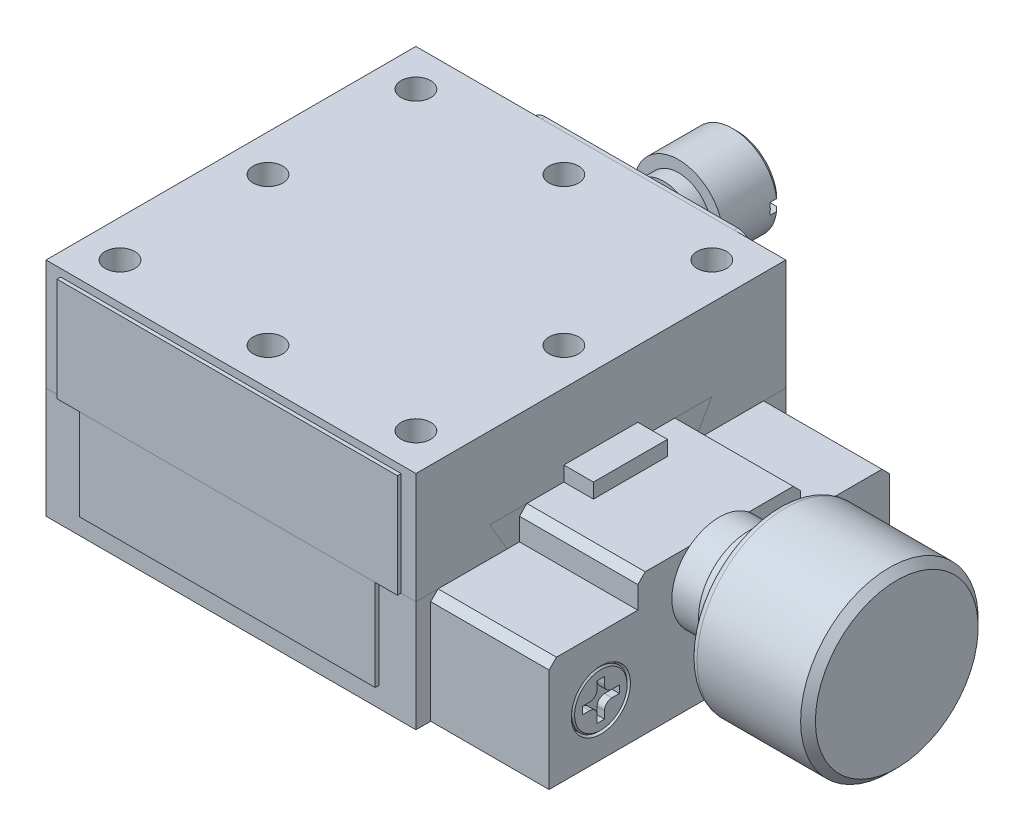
SolidWorks part; units mm, degrees
ref_plane "Front Plane" through (0, 0, 0) normal (0, 0, 1) x (1, 0, 0)
ref_plane "Top Plane" through (0, 0, 0) normal (0, 1, 0) x (1, 0, 0)
ref_plane "Right Plane" through (0, 0, 0) normal (1, 0, 0) x (0, 0, -1)
sketch "Sketch1" plane through (0, 0, 0) normal (0, 0, 1) x (1, 0, 0)
  line L0 (-17.5553, 0) -> (22.6305, 0) construction
  line L1 (-12.5, 7.5) -> (12.5, 7.5)
  line L2 (-12.5, 7.5) -> (-12.5, -7.5)
  line L3 (-12.5, -7.5) -> (12.5, -7.5)
  line L4 (12.5, 7.5) -> (12.5, -7.5)
  line L5 (0, 11.3249) -> (0, -12.2184) construction
  dimension "D1" = 25
  dimension "D2" = 15
extrude "Extrude1" add sketch "Sketch1" against normal mid plane 25
sketch "Sketch3" plane through (-12.5, 0, 0) normal (-1, 0, 0) x (0, 0, 1)
  line L0 (-12.5, 0) -> (-6.3453, 0)
  line L2 (-6.3453, 0) -> (-7.5, 2)
  line L3 (-7.5, 2) -> (7.5, 2)
  line L4 (7.5, 2) -> (6.3453, 0)
  line L5 (6.3453, 0) -> (12.5, 0)
  line L7 (0, 9.2862) -> (0, -8.8555) construction
  line L9 (-12.5, -7.5) -> (12.5, -7.5) construction
  line L10 (-12.5, 7.5) -> (-12.5, -7.5) construction
  line L11 (12.5, 7.5) -> (12.5, -7.5) construction
  dimension "D1" = 15
  dimension "D2" = 2
  dimension "D3" = 60
  dimension "D4" = 7.5
split "Split1" trim tools "Sketch3" resulting bodies 102 103
sketch "Sketch4" plane through (12.5, 0, 0) normal (1, 0, 0) x (0, 0, -1)
  line L0 (-11.5, -7.5) -> (-11.5, 0)
  line L1 (-12.5, 0) -> (-6.3453, 0) construction
  line L2 (-11.5, 0) -> (-5.5, 0)
  line L3 (-5.5, 0) -> (-5.5, 2)
  line L4 (-5.5, 2) -> (5.5, 2)
  line L5 (5.5, 2) -> (5.5, 0)
  line L6 (5.5, 0) -> (11.5, 0)
  line L7 (6.3453, 0) -> (12.5, 0) construction
  line L8 (11.5, 0) -> (11.5, -7.5)
  line L9 (11.5, -7.5) -> (-11.5, -7.5)
  line L10 (0, 10.5069) -> (0, -9.7219) construction
  line L12 (-7.5, 2) -> (7.5, 2) construction
  line L13 (12.5, -7.5) -> (-12.5, -7.5) construction
  dimension "D1" = 11
  dimension "D2" = 23
extrude "Extrude2" add sketch "Sketch4" along normal blind 8 separate body
sketch "Sketch5" plane through (0, 0, 0) normal (0, 0, 1) x (1, 0, 0)
  line L0 (-16.9557, -0.5) -> (34.9975, -0.5) construction
  line L1 (20.5, -0.5) -> (20.5, 2.7)
  line L2 (20.5, 2.7) -> (22.5, 2.7)
  line L3 (22.5, 2.7) -> (22.5, 2.9)
  line L4 (24.5, 2.9) -> (24.5, 5)
  line L5 (25, 5.5) -> (32, 5.5)
  line L6 (32.5, 5) -> (32.5, -0.5)
  line L7 (20.5, 0) -> (20.5, -7.5) construction
  line L8 (12.5, -7.5) -> (12.5, 0) construction
  line L10 (-12.5, -7.5) -> (12.5, -7.5) construction
  line L11 (32, 5.5) -> (32.5, 5)
  line L12 (20.5, 2) -> (12.5, 2) construction
  line L13 (22.5, 2.9) -> (24.5, 2.9)
  line L14 (20.5, -0.5) -> (32.5, -0.5)
  arc A0 (24.5, 5) -> (25, 5.5) centre (25, 5) cw
  point P17 (32.5, 5.5)
  dimension "D4" = 0.5
  dimension "D1" = 20
  dimension "D2" = 12
  dimension "D3" = 7
  dimension "D6" = 0.5
  dimension "D5" = 2
  dimension "D7" = 0.7
  dimension "D8" = 0.2
revolve "Revolve1" add sketch "Sketch5" angle 360 about L0
ref_plane "Plane1" through (0, 0, 10) normal (0, 0, 1) x (1, 0, 0)
sketch "Sketch7" plane through (0, 0, 10) normal (0, 0, 1) x (1, 0, 0)
  line L0 (0, 10.5598) -> (0, -0.7863) construction
  line L1 (12.5, 7.5) -> (-12.5, 7.5) construction
  line L2 (0, 7.5) -> (1, 7.5)
  line L3 (0, 7.5) -> (0, 0.8991)
  line L4 (-0.3822, 1.5) -> (1.4322, 1.5) construction
  line L5 (1, 7.5) -> (1, 1.5)
  line L6 (1, 1.5) -> (0, 0.8991)
  dimension "D1" = 59
  dimension "D2" = 6
  dimension "D3" = 2
revolve "Cut-Revolve1" cut sketch "Sketch7" angle 360 about L0
pattern_linear "LPattern1" count 2 spacing 10 along (1, 0, 0) count 2 spacing 10 along (-1, 0, 0) of "Cut-Revolve1"
pattern_linear "LPattern2" count 2 spacing 20 along (0, 0, -1) of "LPattern1", "Cut-Revolve1"
sketch "Sketch8" plane through (0, 0, 0) normal (0, 0, 1) x (1, 0, 0)
  line L0 (-10, 8.7759) -> (-10, -1.8346) construction
  line L1 (12.5, 7.5) -> (-12.5, 7.5) construction
  line L2 (-10, 7.5) -> (-9, 7.5)
  line L3 (-10, 7.5) -> (-10, 1.3991)
  line L4 (-10, 1.3991) -> (-9, 2)
  line L5 (-9, 7.5) -> (-9, 2)
  line L6 (12.5, 2) -> (-12.5, 2) construction
  dimension "D2" = 2
  dimension "D3" = 10
  dimension "D4" = 59
revolve "Cut-Revolve2" cut sketch "Sketch8" angle 360 about L0
pattern_linear "LPattern3" count 2 spacing 20 along (1, 0, 0) of "Cut-Revolve2"
sketch "Sketch9" plane through (0, 2, 0) normal (0, 1, 0) x (-1, 0, 0)
  line L0 (-12.5, -12.5) -> (-12.5, 12.5) construction
  line L1 (-14.5, -2.5) -> (-12.5, -2.5)
  line L2 (-14.5, -2.5) -> (-14.5, 2.5)
  line L3 (-14.5, 2.5) -> (-12.5, 2.5)
  line L4 (-12.5, -2.5) -> (-12.5, 2.5)
  line L5 (-17.8737, 0) -> (-1.2554, 0) construction
  dimension "D1" = 5
  dimension "D2" = 2
extrude "Extrude3" add sketch "Sketch9" along normal blind 1 separate body
ref_plane "Plane2" through (2.5, 0, 0) normal (1, 0, 0) x (0, 0, -1)
sketch "Sketch10" plane through (2.5, 0, 0) normal (1, 0, 0) x (0, 0, -1)
  line L0 (-16.0871, 4) -> (16.1877, 4) construction
  line L1 (12.5, -7.5) -> (-12.5, -7.5) construction
  line L2 (12.75, 5.98) -> (14.25, 5.98)
  line L3 (12.5, -7.5) -> (12.5, 0) construction
  line L4 (14.25, 5.98) -> (14.25, 6.23)
  line L5 (14.25, 6.23) -> (15.25, 6.23)
  line L6 (15.25, 6.23) -> (15.25, 7)
  line L7 (15.25, 7) -> (18.9, 7)
  line L8 (19.2, 6.7) -> (19.2, 4)
  line L9 (19.2, 4) -> (12.5, 4)
  line L10 (12.75, 4.98) -> (12.75, 5.98)
  line L11 (18.9, 7) -> (19.2, 6.7)
  line L12 (12.5, 0) -> (12.5, 7.5) construction
  line L13 (12.75, 4.98) -> (12.5, 4.98)
  line L14 (12.5, 4.98) -> (12.5, 4)
  point P16 (19.2, 7)
  dimension "D1" = 11.5
  dimension "D2" = 6
  dimension "D3" = 6.7
  dimension "D4" = 0.25
  dimension "D5" = 1
  dimension "D6" = 0.98
  dimension "D7" = 0.25
  dimension "D8" = 1
  dimension "D10" = 0.3
  dimension "D9" = 1.5
revolve "Revolve2" add sketch "Sketch10" angle 360 about L0
sketch "Sketch11" plane through (2.5, 0, 0) normal (1, 0, 0) x (0, 0, -1)
  line L0 (19.2, 1.3) -> (19.2, 6.7) construction
  line L1 (18.45, 4.375) -> (19.2, 4.375)
  line L2 (18.45, 4.375) -> (18.45, 3.625)
  line L3 (18.45, 3.625) -> (19.2, 3.625)
  line L4 (19.2, 4.375) -> (19.2, 3.625)
  line L5 (10.1527, 4) -> (21.4889, 4) construction
  line L6 (-16.0871, 4) -> (16.1877, 4) construction
  dimension "D1" = 0.75
  dimension "D2" = 0.75
extrude "Cut-Extrude2" cut sketch "Sketch11" against normal mid plane 11.5
sketch "Sketch12" plane through (0, 0, 10) normal (0, 0, 1) x (1, 0, 0)
  line L0 (-10, 0.5868) -> (-10, -12.2814) construction
  line L1 (-10, 0) -> (-7.9, 0)
  line L2 (-12.5, 0) -> (12.5, 0) construction
  line L3 (-7.9, 0) -> (-7.9, -3)
  line L4 (-7.9, -3) -> (-8.75, -3)
  line L5 (-8.75, -3) -> (-8.75, -7.5)
  line L6 (-12.5, -7.5) -> (12.5, -7.5) construction
  line L7 (-8.75, -7.5) -> (-10, -7.5)
  line L8 (-10, -7.5) -> (-10, 0)
  dimension "D1" = 10
  dimension "D2" = 2.5
  dimension "D3" = 4.2
  dimension "D4" = 4.5
revolve "Cut-Revolve3" cut sketch "Sketch12" angle 360 about L0
pattern_linear "LPattern4" count 2 spacing 20 along (0, 0, -1) count 2 spacing 20 along (1, 0, 0) of "Cut-Revolve3"
sketch "Sketch13" plane through (0, 0, 12.5) normal (0, 0, 1) x (1, 0, 0)
  line L0 (-11.5, -5.15) -> (-11.5, 0)
  line L2 (11.5, 0) -> (11.5, -5.15)
  line L4 (-11.5, 0) -> (11.5, 0)
  line L6 (-12.5, 0) -> (12.5, 0) construction
  line L8 (10.5, -6.15) -> (-10.5, -6.15)
  line L11 (0, 14.0975) -> (0, -10.6657) construction
  arc A0 (-11.5, -5.15) -> (-10.5, -6.15) centre (-10.5, -5.15) ccw
  arc A1 (10.5, -6.15) -> (11.5, -5.15) centre (10.5, -5.15) ccw
  point P24 (-11.5, -6.15)
  dimension "D3" = 1
  dimension "D1" = 6.15
  dimension "D2" = 23
extrude "Extrude4" add sketch "Sketch13" along normal blind 0.25 separate body
sketch "Sketch14" plane through (0, 0, -12.5) normal (0, 0, -1) x (-1, 0, 0)
  line L0 (12.5, -7.5) -> (-12.5, -7.5) construction
  line L2 (5, -6.5) -> (5, 6.5)
  line L3 (-12.5, 7.5) -> (12.5, 7.5) construction
  line L4 (4, 7.5) -> (-9, 7.5)
  line L5 (-10, 6.5) -> (-10, -6.5)
  line L6 (-12.5, 0) -> (-12.5, 7.5) construction
  line L7 (-8, 5) -> (3, 5)
  line L8 (-8.5, 4.5) -> (-8.5, 3.5)
  line L9 (-8, 3) -> (3, 3)
  line L10 (3.5, 4.5) -> (3.5, 3.5)
  line L11 (-2.5, 14.1335) -> (-2.5, -6.1072) construction
  line L12 (-14.0826, 4) -> (7.454, 4) construction
  line L13 (-9, -7.5) -> (4, -7.5)
  arc A0 (-10, -6.5) -> (-9, -7.5) centre (-9, -6.5) ccw
  arc A1 (-9, 7.5) -> (-10, 6.5) centre (-9, 6.5) ccw
  arc A2 (5, 6.5) -> (4, 7.5) centre (4, 6.5) ccw
  arc A3 (5, -6.5) -> (4, -7.5) centre (4, -6.5) cw
  arc A5 (-8, 5) -> (-8.5, 4.5) centre (-8, 4.5) ccw
  arc A6 (-8.5, 3.5) -> (-8, 3) centre (-8, 3.5) ccw
  arc A7 (3, 3) -> (3.5, 3.5) centre (3, 3.5) ccw
  arc A8 (3, 5) -> (3.5, 4.5) centre (3, 4.5) cw
  point P20 (-10, 7.5)
  point P23 (5, 7.5)
  point P32 (-8.5, 5)
  point P39 (3.5, 5)
  point P40 (-10, -7.5)
  point P43 (5, -7.5)
  dimension "D5" = 1
  dimension "D6" = 0.5
  dimension "D9" = 1
  dimension "D1" = 2.5
  dimension "D2" = 15
  dimension "D4" = 12
  dimension "D7" = 2
  dimension "D8" = 11.5
extrude "Extrude6" add sketch "Sketch14" along normal blind 0.25 separate body
sketch "Sketch26" plane through (0, 0, 12.5) normal (0, 0, 1) x (1, 0, 0)
  line L0 (11.5, -5.15) -> (11.5, 0) construction
  line L1 (-11.5, 0) -> (11.5, 0)
  line L2 (-11.5, 0) -> (-11.5, 7)
  line L3 (-11.5, 7) -> (11.5, 7)
  line L4 (11.5, 0) -> (11.5, 7)
  dimension "D1" = 7
extrude "Extrude9" add sketch "Sketch26" along normal blind 0.25 separate body
sketch "Sketch15" plane through (20.5, 0, 0) normal (1, 0, 0) x (0, 0, -1)
  line L0 (0, 12.9894) -> (0, -12.6202) construction
  circle A0 centre (-8, -4) radius 2
  circle A1 centre (8, -4) radius 2
  dimension "D1" = 4
  dimension "D2" = 16
  dimension "D3" = 4
extrude "Cut-Extrude3" cut sketch "Sketch15" against normal blind 2
sketch "Sketch16" plane through (18.5, 0, 0) normal (1, 0, 0) x (0, 0, -1)
  circle A0 centre (-8, -4) radius 1.875
  circle A1 centre (-8, -4) radius 2 construction
  dimension "D1" = 3.75
extrude "Extrude7" add sketch "Sketch16" along normal blind 2 separate body
chamfer "Chamfer1" distance 0.1 angle 45 1 edges at (20.5, -2.125, 8)
sketch "Sketch17" plane through (20.5, 0, 0) normal (1, 0, 0) x (0, 0, -1)
  line L0 (-8, -2.6113) -> (-8, -5.3425) construction
  line L1 (-9.4433, -4) -> (-6.9033, -4) construction
  line L2 (-9.25, -4.25) -> (-9.25, -3.75)
  line L3 (-9.25, -3.75) -> (-8.25, -3.75)
  line L4 (-8.25, -3.75) -> (-8.25, -2.75)
  line L5 (-8.25, -2.75) -> (-7.75, -2.75)
  line L6 (-7.75, -2.75) -> (-7.75, -3.75)
  line L7 (-7.75, -3.75) -> (-6.75, -3.75)
  line L8 (-6.75, -3.75) -> (-6.75, -4.25)
  line L9 (-6.75, -4.25) -> (-7.75, -4.25)
  line L10 (-7.75, -4.25) -> (-7.75, -5.25)
  line L11 (-7.75, -5.25) -> (-8.25, -5.25)
  line L12 (-8.25, -5.25) -> (-8.25, -4.25)
  line L13 (-8.25, -4.25) -> (-9.25, -4.25)
  dimension "D1" = 0.5
  dimension "D2" = 8
  dimension "D3" = 2.5
  dimension "D4" = 2.5
  dimension "D5" = 0.5
  dimension "D6" = 4
extrude "Cut-Extrude4" cut sketch "Sketch17" against normal blind 0.5
fillet "Fillet2" radius 0.5 4 edges at (20.25, -4.25, 7.75) (20.25, -4.25, 8.25) (20.25, -3.75, 8.25) (20.25, -3.75, 7.75)
pattern_linear "LPattern5" count 2 spacing 16 along (0, 0, -1)
sketch "Sketch18" plane through (0, 0, -12.75) normal (0, 0, -1) x (-1, 0, 0)
  line L0 (-2.5, 10.7386) -> (-2.5, -9.8413) construction
  line L1 (-9, -7.5) -> (4, -7.5) construction
  circle A0 centre (-4.5, -5) radius 1
  circle A1 centre (-0.5, -5) radius 1
  dimension "D2" = 2
  dimension "D1" = 2.5
  dimension "D3" = 2.5
  dimension "D4" = 4
extrude "Extrude8" add sketch "Sketch18" along normal blind 0.8 separate body
fillet "Fillet1" radius 0.25 1 edges at (3.5, -5, -13.55)
fillet "Fillet3" radius 0.25 1 edges at (-0.5, -5, -13.55)
sketch "Sketch19" plane through (0, 0, -13.55) normal (0, 0, -1) x (-1, 0, 0)
  line L0 (-8.4281, -5) -> (-5.6071, -5) construction
  line L1 (-4.6, -4.25) -> (-4.4, -4.25)
  line L2 (-4.4, -4.25) -> (-4.4, -4.9)
  line L3 (-4.4, -4.9) -> (-3.75, -4.9)
  line L4 (-3.75, -4.9) -> (-3.75, -5.1)
  line L5 (-3.75, -5.1) -> (-4.4, -5.1)
  line L6 (-4.4, -5.1) -> (-4.4, -5.75)
  line L7 (-4.4, -5.75) -> (-4.6, -5.75)
  line L8 (-4.6, -5.75) -> (-4.6, -5.1)
  line L9 (-4.6, -5.1) -> (-5.25, -5.1)
  line L10 (-5.25, -5.1) -> (-5.25, -4.9)
  line L11 (-5.25, -4.9) -> (-4.6, -4.9)
  line L12 (-4.6, -4.9) -> (-4.6, -4.25)
  line L13 (-4.5, 2.5) -> (-4.5, 0.5) construction
  line L14 (-0.6, -5.1) -> (-0.6, -5.75)
  line L15 (-9, -7.5) -> (4, -7.5) construction
  line L16 (-0.4, -5.1) -> (-0.4, -5.75)
  line L17 (-0.5, -2.5823) -> (-0.5, -6.9988) construction
  line L20 (-1.25, -4.9) -> (-0.6, -4.9)
  line L21 (-1.25, -4.9) -> (-1.25, -5.1)
  line L22 (-1.25, -5.1) -> (-0.6, -5.1)
  line L24 (0.25, -4.9) -> (-0.4, -4.9)
  line L25 (0.25, -4.9) -> (0.25, -5.1)
  line L26 (0.25, -5.1) -> (-0.4, -5.1)
  line L28 (-0.6, -4.25) -> (-0.4, -4.25)
  line L29 (-0.6, -4.25) -> (-0.6, -4.9)
  line L30 (-0.6, -5.75) -> (-0.4, -5.75)
  line L31 (-0.4, -4.25) -> (-0.4, -4.9)
  dimension "D1" = 1.5
  dimension "D2" = 0.2
  dimension "D3" = 4.5
  dimension "D4" = 2.5
  dimension "D5" = 1.5
  dimension "D6" = 4
extrude "Cut-Extrude5" cut sketch "Sketch19" against normal blind 0.25
sketch "Sketch20" plane through (0, 0, 12.75) normal (0, 0, 1) x (1, 0, 0)
  line L0 (-10.5, -6.15) -> (10.5, -6.15) construction
  line L1 (11.5, 0) -> (-11.5, 0) construction
  line L2 (-11.5, 0) -> (-11.5, -6.15)
  line L3 (-11.5, -6.15) -> (-10, -6.15)
  line L4 (-10, 0) -> (-10, -6.15)
  line L6 (0, 12.0283) -> (0, -10.5142) construction
  line L7 (10, 0) -> (10, -6.15)
  line L8 (11.5, -6.15) -> (10, -6.15)
  line L9 (11.5, 0) -> (11.5, -6.15)
  line L10 (11.5, 0) -> (10, 0)
  line L11 (-11.5, 0) -> (-11.5, -5.15) construction
  line L12 (-11.5, 0) -> (-10, 0)
  dimension "D1" = 1.5
extrude "Cut-Extrude6" cut sketch "Sketch20" against normal up to next
chamfer "Chamfer2" distance 0.5 angle 45 4 edges at (16.5, 2, 5.5) (16.5, 2, -5.5) (16.5, 0, -11.5) (16.5, 0, 11.5)
sketch "草圖1" plane through (-12.5, 0, -25) normal (1, 0, 0) x (0, 0, -1)
  line L1 (-16.1981, -4.1156) -> (-15.311, -4.1204)
  line L2 (-17.0651, -2.4109) -> (-17.0651, -2.4974)
  line L3 (-16.2352, -3.1633) -> (-15.9187, -3.5702)
  line L40 (-16.573, -3.1631) -> (-16.2352, -3.1633)
  line L41 (-16.1981, -4.1156) -> (-16.573, -3.1631)
  line L42 (-17.6614, -2.8336) -> (-18.1987, -2.8336)
  line L43 (-18.2924, -2.5911) -> (-18.2924, -2.74)
  line L44 (-18.0266, -3.531) -> (-17.6614, -3.531)
  line L45 (-18.0266, -3.3031) -> (-18.0266, -3.531)
  line L46 (-18.0266, -3.3031) -> (-17.7774, -3.3031)
  line L47 (-17.6837, -3.0489) -> (-17.6837, -3.2095)
  line L48 (-18.2858, -3.0489) -> (-18.2858, -3.7827)
  line L49 (-18.2858, -3.0489) -> (-17.6837, -3.0489)
  line L50 (-19.4085, -2.5911) -> (-19.0585, -3.4026)
  line L51 (-19.4521, -3.0898) -> (-19.1461, -3.7827)
  line L52 (-19.4521, -3.0898) -> (-19.4521, -3.6891)
  line L53 (-19.7468, -2.5911) -> (-19.7468, -3.7827)
  line L54 (-18.665, -3.0898) -> (-18.971, -3.7827)
  line L55 (-18.665, -3.0898) -> (-18.665, -3.6891)
  line L56 (-18.7085, -2.5911) -> (-19.0585, -3.4026)
  line L57 (-18.2858, -3.7827) -> (-17.6614, -3.7827)
  line L58 (-18.5713, -3.7827) -> (-18.3702, -3.7827)
  line L59 (-19.1461, -3.7827) -> (-18.971, -3.7827)
  line L60 (-19.7468, -3.7827) -> (-19.5457, -3.7827)
  line L61 (-18.3702, -2.5911) -> (-18.3702, -3.7827)
  line L62 (-18.2924, -2.5911) -> (-17.6614, -2.5911)
  line L63 (-18.7085, -2.5911) -> (-18.3702, -2.5911)
  line L64 (-19.7468, -2.5911) -> (-19.4085, -2.5911)
  line L65 (-20.3083, -3.7834) -> (-20.5174, -3.7851)
  line L66 (-20.2154, -2.8878) -> (-20.2154, -3.6898)
  line L67 (-19.8284, -2.8878) -> (-20.2154, -2.8878)
  line L68 (-19.8284, -2.5911) -> (-19.8284, -2.8878)
  line L69 (-20.9095, -2.5911) -> (-19.8284, -2.5911)
  line L70 (-20.9095, -2.7998) -> (-20.9095, -2.5911)
  line L71 (-20.5174, -2.8934) -> (-20.8159, -2.8934)
  line L72 (-20.5174, -2.8934) -> (-20.5174, -3.7851)
  arc A44 (-17.0651, -2.4109) -> (-16.9244, -2.4189) centre (-17.0496, -3.3828) cw
  arc A45 (-16.6772, -2.442) -> (-16.9244, -2.4189) centre (-15.3108, 13.5103) cw
  arc A46 (-16.7864, -2.4322) -> (-16.5941, -2.4511) centre (-17.1549, -7.1859) cw
  arc A47 (-16.5941, -2.4511) -> (-16.3851, -2.4781) centre (-16.7619, -4.5724) cw
  arc A48 (-16.3851, -2.4781) -> (-16.1496, -2.5058) centre (-16.4783, -4.2807) cw
  arc A49 (-16.1496, -2.5058) -> (-15.9475, -2.5343) centre (-16.209, -3.6581) cw
  arc A50 (-15.7222, -2.5771) -> (-15.9475, -2.5343) centre (-15.4093, -0.3111) cw
  arc A51 (-15.7222, -2.5771) -> (-15.4621, -2.6273) centre (-17.0996, -10.4031) cw
  arc A52 (-15.4621, -2.6273) -> (-15.1846, -2.6976) centre (-16.2634, -6.3745) cw
  arc A53 (-15.1846, -2.6976) -> (-14.9177, -2.7748) centre (-15.7421, -5.1236) cw
  arc A54 (-14.9177, -2.7748) -> (-14.7336, -2.84) centre (-28.3932, -41.1646) cw
  arc A55 (-14.7336, -2.84) -> (-14.4724, -2.9583) centre (-15.8525, -5.6559) cw
  arc A56 (-14.4724, -2.9583) -> (-14.1987, -3.1141) centre (-16.0097, -5.9785) cw
  arc A57 (-14.1987, -3.1141) -> (-13.9713, -3.3372) centre (-14.9246, -4.0815) cw
  arc A58 (-13.9713, -3.3372) -> (-13.8744, -3.5708) centre (-14.2826, -3.6031) cw
  arc A59 (-13.8744, -3.5708) -> (-13.9502, -3.7497) centre (-14.1121, -3.5756) cw
  arc A60 (-13.9502, -3.7497) -> (-14.245, -3.9392) centre (-14.5856, -3.0851) cw
  arc A61 (-14.245, -3.9392) -> (-14.6816, -4.0519) centre (-15.1643, -1.28) cw
  arc A62 (-14.6816, -4.0519) -> (-15.0135, -4.0942) centre (-15.4536, 0.6734) cw
  arc A63 (-15.311, -4.1204) -> (-15.0135, -4.0942) centre (-12.6714, -32.4168) cw
  arc A64 (-17.0651, -2.4974) -> (-16.9142, -2.5137) centre (-17.1052, -3.5767) cw
  arc A65 (-16.9142, -2.5137) -> (-16.729, -2.5393) centre (-18.8958, -17.5551) cw
  arc A66 (-16.5268, -2.5702) -> (-16.729, -2.5393) centre (-16.4493, -1.3852) cw
  arc A67 (-16.2993, -2.6109) -> (-16.5268, -2.5702) centre (-16.0828, -0.7447) cw
  arc A68 (-16.2993, -2.6109) -> (-16.0587, -2.6574) centre (-17.5664, -9.8163) cw
  arc A69 (-15.8705, -2.6967) -> (-16.0587, -2.6574) centre (-15.65, -1.1709) cw
  arc A70 (-15.8705, -2.6967) -> (-15.6458, -2.7556) centre (-16.0752, -3.9343) cw
  arc A71 (-15.4193, -2.8232) -> (-15.6458, -2.7556) centre (-10.0771, 15.4936) cw
  arc A72 (-15.1665, -2.9229) -> (-15.4193, -2.8232) centre (-13.2471, 2.3154) cw
  arc A73 (-15.1665, -2.9229) -> (-14.9629, -3.0338) centre (-15.8291, -4.3818) cw
  arc A74 (-14.9629, -3.0338) -> (-14.8122, -3.1675) centre (-15.3005, -3.5659) cw
  arc A75 (-14.8122, -3.1675) -> (-14.7678, -3.2687) centre (-14.96, -3.2928) cw
  arc A76 (-14.7678, -3.2687) -> (-14.8383, -3.3911) centre (-14.9084, -3.2692) cw
  arc A77 (-14.8383, -3.3911) -> (-15.1184, -3.5058) centre (-15.2533, -2.7769) cw
  arc A78 (-15.1184, -3.5058) -> (-15.4786, -3.5538) centre (-15.4959, -2.0486) cw
  arc A79 (-15.4786, -3.5538) -> (-15.9187, -3.5702) centre (-15.872, 1.0836) cw
  arc A80 (-17.6614, -2.5911) -> (-17.6614, -3.7827) centre (-17.7632, -3.1869) cw
  arc A81 (-17.6614, -2.8336) -> (-17.6614, -3.531) centre (-17.879, -3.1823) cw
  arc A82 (-18.1987, -2.8336) -> (-18.2924, -2.74) centre (-18.1987, -2.74) cw
  arc A83 (-17.6837, -3.2095) -> (-17.7774, -3.3031) centre (-17.7774, -3.2095) cw
  arc A84 (-19.4521, -3.6891) -> (-19.5457, -3.7827) centre (-19.5457, -3.6891) cw
  arc A85 (-18.5713, -3.7827) -> (-18.665, -3.6891) centre (-18.5713, -3.6891) cw
  arc A86 (-20.2154, -3.6898) -> (-20.3083, -3.7834) centre (-20.309, -3.6898) cw
  arc A87 (-20.8159, -2.8934) -> (-20.9095, -2.7998) centre (-20.8159, -2.7998) cw
sketch "草圖2" plane through (-12.5, 0, 0) normal (-1, 0, 0) x (0, 0, 1)
  line L0 (-12.5, 0) -> (-12.5, -7.5) construction
  line L1 (-11.3, -1.5) -> (-8.3, -1.5)
  line L2 (-11.3, -1.5) -> (-11.3, -4.5)
  line L3 (-11.3, -4.5) -> (-8.3, -4.5)
  line L4 (-8.3, -1.5) -> (-8.3, -4.5)
  line L6 (-12.5, -7.5) -> (12.5, -7.5) construction
  dimension "D1" = 3
  dimension "D2" = 3
  dimension "D3" = 1.2
  dimension "D4" = 3
extrude "除料-伸長2" cut sketch "草圖2" against normal blind 0.01
extrude "除料-伸長4" cut sketch "草圖1" along normal blind 0.02
sketch "草圖3" plane through (-12.5, 0, 0) normal (-1, 0, 0) x (0, 0, 1)
  line L0 (2.4554, -6.5) -> (11.5, -6.5) construction
  line L1 (12.5, 0) -> (12.5, -7.5) construction
  line L3 (-12.5, -7.5) -> (12.5, -7.5) construction
  text T0 "<i>Made in Taiwan</i>" font "Century Gothic" height 0.8
  dimension "D1" = 1
  dimension "D2" = 1
extrude "除料-伸長5" cut sketch "草圖3" against normal blind 0.02
sketch "草圖4" plane through (-12.5, 0, 0) normal (-1, 0, 0) x (0, 0, 1)
  line L0 (2.6424, -3) -> (11, -3) construction
  line L2 (12.5, 0) -> (12.5, -6.15) construction
  line L3 (-12.5, -7.5) -> (12.5, -7.5) construction
  text T0 "<i>MC2A-25</i>" font "Century Gothic" height 1.2
  dimension "D1" = 1.5
  dimension "D2" = 4.5
extrude "除料-伸長6" cut sketch "草圖4" against normal blind 0.01
